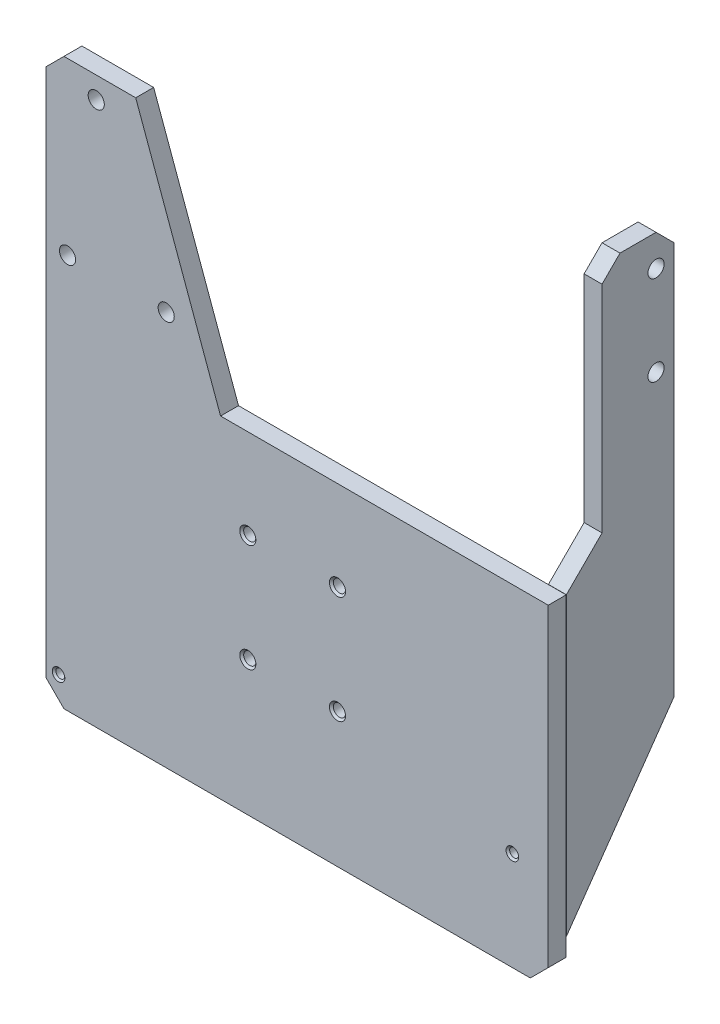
SolidWorks part; units mm, degrees
ref_plane "Plan de face" through (0, 0, 0) normal (0, 0, 1) x (1, 0, 0)
ref_plane "Plan de dessus" through (0, 0, 0) normal (0, 1, 0) x (1, 0, 0)
ref_plane "Plan de droite" through (0, 0, 0) normal (1, 0, 0) x (0, 0, -1)
sketch "Esquisse3" plane through (0, 0, 0) normal (0, 0, 1) x (1, 0, 0)
  line L0 (135, -45) -> (-145, -45)
  line L1 (-145, -45) -> (-145, 270)
  line L2 (-145, 270) -> (-95, 270)
  line L4 (-47.6839, 140) -> (135, 140)
  line L5 (135, 140) -> (135, -45)
  line L6 (-95, 270) -> (-47.6839, 140)
  dimension "D1" = 280
  dimension "D2" = 135
  dimension "D3" = 185
  dimension "D4" = 110
  dimension "D5" = 50
  dimension "D6" = 140
  dimension "D8" = 130
extrude "Extrusion2" add sketch "Esquisse3" along normal blind 10
chamfer "Chanfrein2" distance 10 angle 45 3 edges at (-145, 270, 5) (135, -45, 5) (-145, -45, 5)
sketch "Esquisse4" plane through (0, 0, 10) normal (0, 0, 1) x (1, 0, 0)
  line L0 (-145, 260) -> (-145, -35) construction
  line L1 (-95, 270) -> (-135, 270) construction
  circle A0 centre (-117, 258) radius 4.5
  circle A1 centre (-133, 175) radius 4.5
  circle A2 centre (-78, 175) radius 4.5
  point P8 (-115, 270)
  dimension "D1" = 9
  dimension "D2" = 55
  dimension "D3" = 12
  dimension "D4" = 12
  dimension "D5" = 28
  dimension "D6" = 95
extrude "Enlèv. mat.-Extru.1" cut sketch "Esquisse4" against normal through all
sketch "Esquisse7" plane through (135, 0, 0) normal (1, 0, 0) x (0, 0, -1)
  line L0 (0, -35) -> (0, 140) construction
  line L1 (30, 290) -> (50.1, 290)
  line L2 (0.1, 140) -> (0.1, -25)
  line L3 (0, -45) -> (-10, -45) construction
  line L4 (60.1, 280) -> (60.1, 60.6889)
  line L6 (0.1, -25) -> (60.1, 60.6889)
  line L7 (20, 280) -> (20, 159.9)
  line L8 (-10, 140) -> (0, 140) construction
  line L9 (0, 140) -> (0, 270) construction
  line L11 (50.1, 290) -> (60.1, 280)
  line L12 (30, 290) -> (20, 280)
  line L13 (0.1, 140) -> (20, 159.9)
  point P1 (-5, -45)
  dimension "D1" = 0.1
  dimension "D2" = 20
  dimension "D3" = 20
  dimension "D4" = 60
  dimension "D5" = 35
  dimension "D6" = 315
  dimension "D7" = 45
  dimension "D8" = 45
  dimension "D9" = 10
  dimension "D10" = 10
  dimension "D11" = 45
extrude "Extrusion3" add sketch "Esquisse7" against normal blind 10
sketch "Esquisse8" plane through (135, 0, 0) normal (1, 0, 0) x (0, 0, -1)
  line L0 (60.1, 60.6889) -> (60.1, 280) construction
  line L1 (50.1, 290) -> (30, 290) construction
  circle A0 centre (50.1, 272.5) radius 4.5
  circle A1 centre (50.1, 222.5) radius 4.5
  dimension "D1" = 9
  dimension "D2" = 50
  dimension "D3" = 10
  dimension "D4" = 17.5
extrude "Enlèv. mat.-Extru.3" cut sketch "Esquisse8" against normal through all
hole_wizard "Trou taraudé M61" positions "Esquisse3D2" profile "Esquisse9" tap size "M6" standard "ISO"
sketch3d "Esquisse3D2"
  line L0 (-145, 260, 10) -> (-145, -35, 10) construction
  point P0 (-138, -30, 10)
  point P12 (115, 10, 10)
  dimension "D1" = 15
  dimension "D2" = 20
  dimension "D3" = 7
  dimension "D4" = 55
sketch "Esquisse9" plane through (-138, -30, 10) normal (1, 0, 0) x (0, -1, 0)
  line L0 (0, 0) -> (0, 70.1)
  line L1 (0, 70.1) -> (2.5, 70.1)
  line L2 (2.5, 70.1) -> (2.5, 1)
  line L3 (2.5, 1) -> (3.5, 0)
  line L5 (3.5, 0) -> (0, 0)
  line L6 (-2.5, 1) -> (-3.5, 0) construction
  line L11 (0, -6.35) -> (0, 107.95) construction
  dimension "Diamètre du trou pour taraudage jusqu'au prochain" = 5
  dimension "Profondeur du trou pour taraudage jusqu'au prochain" = 70.1
  dimension "Diamètre du fraisage entrant" = 7
  dimension "Angle du fraisage entrant" = 90
hole_wizard "Trou taraudé M81" positions "Esquisse3D3" profile "Esquisse10" tap size "M8" standard "ISO"
sketch3d "Esquisse3D3"
  point P0 (-32.5, 90, 10)
  point P2 (17.5, 90, 10)
  point P4 (-32.5, 30, 10)
  point P6 (17.5, 30, 10)
  dimension "D1" = 50
  dimension "D2" = 112.5
  dimension "D3" = 60
  dimension "D4" = 75
sketch "Esquisse10" plane through (-32.5, 90, 10) normal (1, 0, 0) x (0, -1, 0)
  line L0 (0, 0) -> (0, 70.1)
  line L1 (0, 70.1) -> (3.4, 70.1)
  line L2 (3.4, 70.1) -> (3.4, 1.1)
  line L3 (3.4, 1.1) -> (4.5, 0)
  line L5 (4.5, 0) -> (0, 0)
  line L6 (-3.4, 1.1) -> (-4.5, 0) construction
  line L11 (0, -6.35) -> (0, 107.95) construction
  dimension "Diamètre du trou pour taraudage jusqu'au prochain" = 6.8
  dimension "Profondeur du trou pour taraudage jusqu'au prochain" = 70.1
  dimension "Diamètre du fraisage entrant" = 9
  dimension "Angle du fraisage entrant" = 90
